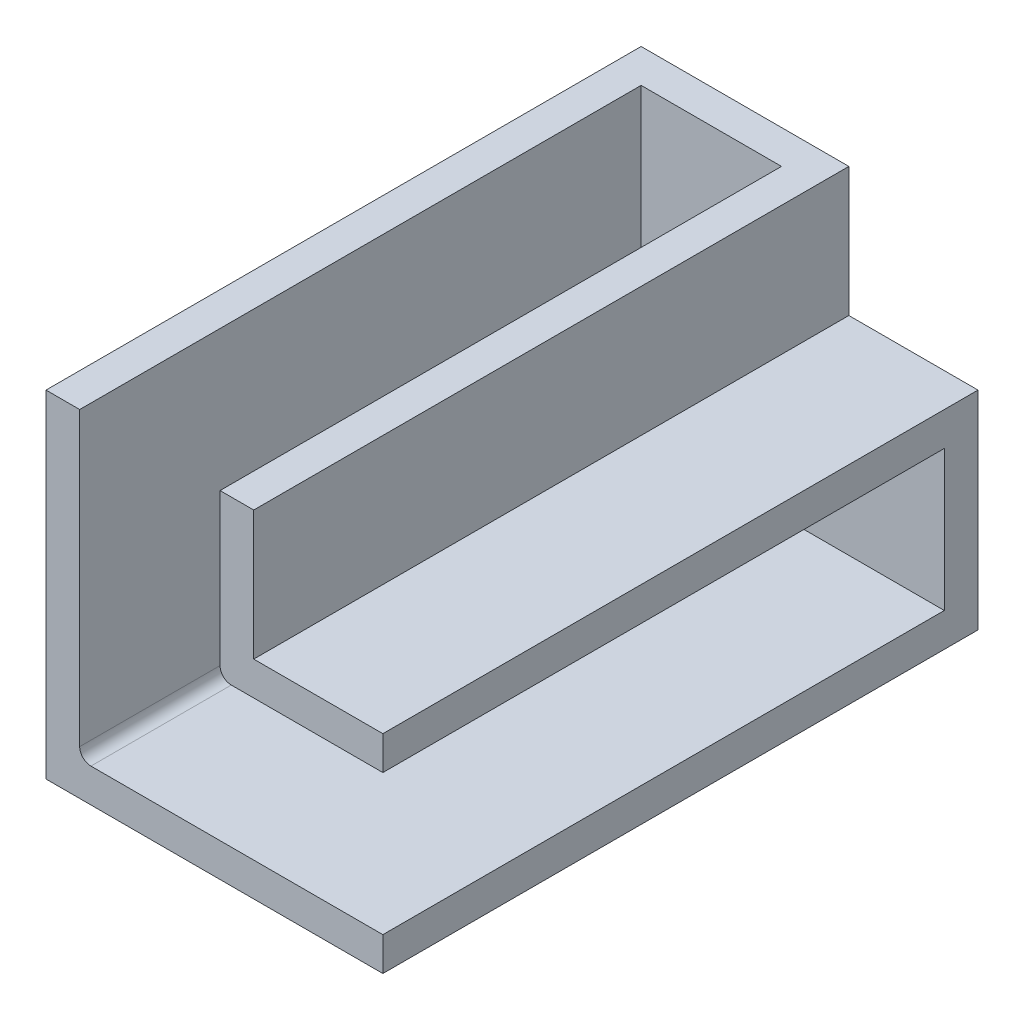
SolidWorks part; units mm, degrees
ref_plane "Front Plane" through (0, 0, 0) normal (0, 0, 1) x (1, 0, 0)
ref_plane "Top Plane" through (0, 0, 0) normal (0, 1, 0) x (1, 0, 0)
ref_plane "Right Plane" through (0, 0, 0) normal (1, 0, 0) x (0, 0, -1)
sketch "Sketch1" plane through (0, 0, 0) normal (0, 0, 1) x (1, 0, 0)
  line L1 (-50.5714, -7.3571) -> (-32.0714, -7.3571)
  line L2 (-50.5714, -7.3571) -> (-50.5714, -37.3571)
  line L4 (-32.0714, -7.3571) -> (-32.0714, -18.8571)
  line L5 (-32.0714, -18.8571) -> (-20.5714, -18.8571)
  line L7 (-50.5714, -37.3571) -> (-20.5714, -37.3571)
  line L8 (-20.5714, -18.8571) -> (-20.5714, -37.3571)
  dimension "D1" = 30
  dimension "D2" = 30
  dimension "D3" = 18.5
extrude "Boss-Extrude1" add sketch "Sketch1" along normal blind 53
shell "Shell3" thickness 3
fillet "Fillet1" radius 1 2 edges at (-47.5714, -34.3571, 28) (-35.0714, -21.8571, 28)
